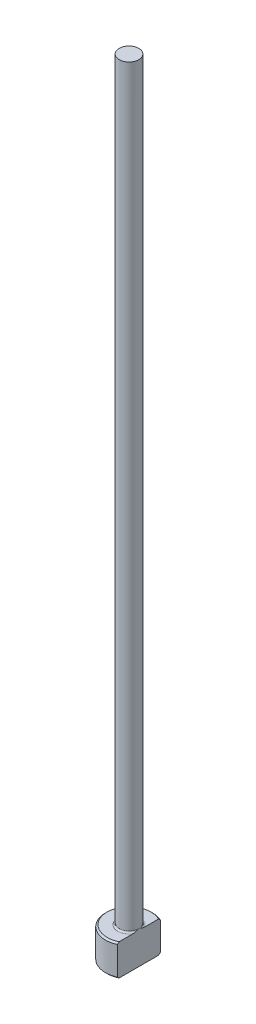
SolidWorks part; units mm, degrees
ref_plane "Front Plane" through (0, 0, 0) normal (0, 0, 1) x (1, 0, 0)
ref_plane "Top Plane" through (0, 0, 0) normal (0, 1, 0) x (1, 0, 0)
ref_plane "Right Plane" through (0, 0, 0) normal (1, 0, 0) x (0, 0, -1)
sketch "Sketch1" plane through (0, 0, 0) normal (0, 0, 1) x (1, 0, 0)
  line L0 (0, 259.9588) -> (0, -15.1925) construction
  line L1 (0, 0) -> (-3, 0)
  line L2 (-3, 0) -> (-3, 4)
  line L3 (-3, 4) -> (-1.25, 4)
  line L4 (-1.25, 4) -> (-1.25, 100)
  line L5 (-1.25, 100) -> (0, 100)
  line L6 (0, 100) -> (0, 0)
  dimension "L" = 100
  dimension "H" = 6
  dimension "T" = 4
  dimension "D" = 2.5
revolve "Revolve1" add sketch "Sketch1" angle 360 about L0
chamfer "Chamfer1" distance 0.2 angle 45 2 edges at (0, 4, 3) (0, 0, 3)
fillet "Fillet1" radius 0.2 1 edges at (0, 4, 1.25)
sketch "Sketch2" plane through (0, 0, 0) normal (0, 1, 0) x (1, 0, 0)
  line L0 (1.25, -2.7272) -> (1.25, 2.7272)
  circle A0 centre (0, 0) radius 3 construction
  arc A1 (1.25, -2.7272) -> (1.25, 2.7272) centre (0, 0) ccw
  circle A2 centre (0, 0) radius 1.25 construction
extrude "KEYED HEAD" cut sketch "Sketch2" along normal through all
